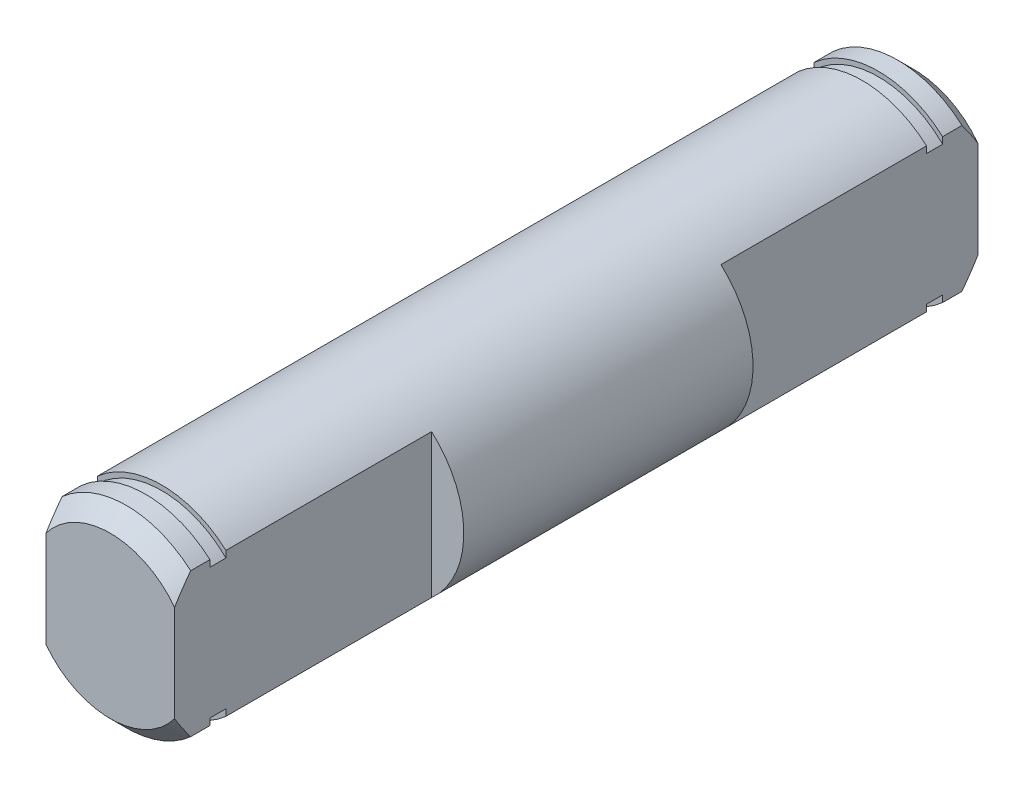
SolidWorks part; units mm, degrees
ref_plane "Plan de face" through (0, 0, 0) normal (0, 0, 1) x (1, 0, 0)
ref_plane "Plan de dessus" through (0, 0, 0) normal (0, 1, 0) x (1, 0, 0)
ref_plane "Plan de droite" through (0, 0, 0) normal (1, 0, 0) x (0, 0, -1)
sketch "Esquisse1" plane through (0, 0, 0) normal (0, 0, 1) x (1, 0, 0)
  circle A0 centre (0, 0) radius 3
  dimension "D1" = 6
extrude "Extrusion1" add sketch "Esquisse1" along normal blind 12.5
chamfer "Chanfrein1" distance 0.5 angle 45 1 edges at (3, 0, 12.5)
sketch "Esquisse2" plane through (0, 0, 0) normal (0, 1, 0) x (1, 0, 0)
  line L0 (0, 0) -> (0, -13.0327) construction
  line L1 (3.6513, -10.9) -> (2.85, -10.9)
  line L2 (3.6513, -10.9) -> (3.6513, -11.4)
  line L3 (3.6513, -11.4) -> (2.85, -11.4)
  line L4 (2.85, -10.9) -> (2.85, -11.4)
  dimension "D1" = 0.5
  dimension "D2" = 11.4
  dimension "D3" = 5.7
revolve "Enlèvement de matière-Révolution1" cut sketch "Esquisse2" angle 360 about L0
sketch "Esquisse3" plane through (0, 0, 12.5) normal (0, 0, 1) x (1, 0, 0)
  line L1 (-2, 3.3001) -> (2, 3.3001)
  line L2 (-2, 3.3001) -> (-2, -3.2224)
  line L3 (-2, -3.2224) -> (2, -3.2224)
  line L4 (2, 3.3001) -> (2, -3.2224)
  dimension "D1" = 4
  dimension "D2" = 2
extrude "Enlèv. mat.-Extru.1" cut sketch "Esquisse3" against normal blind 8 flip side to cut
mirror "Symétrie1" about plane through (0, 0, 0) normal (0, 0, 1)
